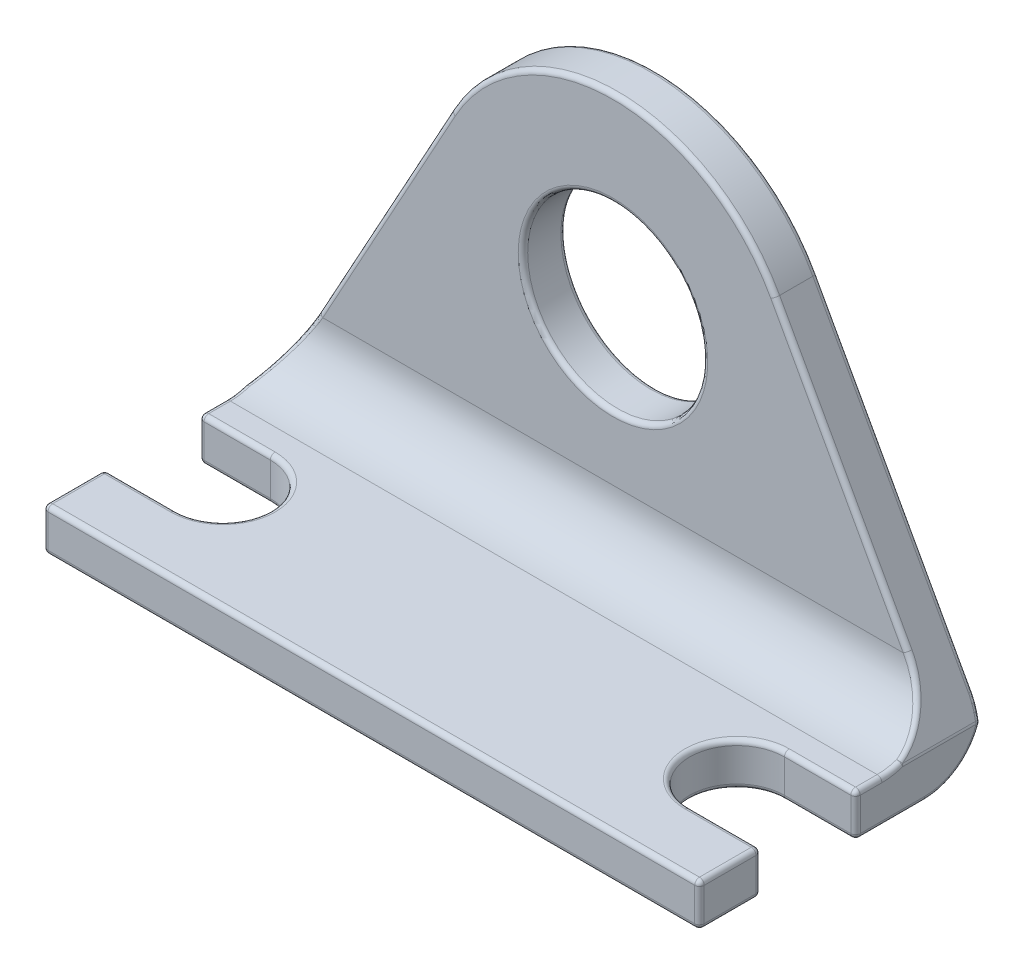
SolidWorks part; units mm, degrees
ref_plane "Front" through (0, 0, 0) normal (0, 0, 1) x (1, 0, 0)
ref_plane "Top" through (0, 0, 0) normal (0, 1, 0) x (1, 0, 0)
ref_plane "Right" through (0, 0, 0) normal (1, 0, 0) x (0, 0, -1)
sketch "Sketch1" plane through (0, 0, 0) normal (0, 1, 0) x (1, 0, 0)
  line L1 (0, 0) -> (35.179, 0)
  line L2 (0, 0) -> (0, 15.24)
  line L3 (0, 15.24) -> (35.179, 15.24)
  line L4 (35.179, 0) -> (35.179, 15.24)
  dimension "D1" = 15.24
  dimension "D2" = 35.179
extrude "Extrude1" add sketch "Sketch1" along normal blind 2.286
sketch "Sketch2" plane through (0, 0, -15.24) normal (0, 0, -1) x (-1, 0, 0)
  line L0 (-35.179, 2.286) -> (-35.179, 0) construction
  line L1 (-35.179, 0) -> (0, 0) construction
  line L2 (-35.179, 2.286) -> (-26.2698, 18.4889)
  line L3 (0, 2.286) -> (-8.9092, 18.4889)
  line L4 (-35.179, 2.286) -> (0, 2.286)
  circle A0 centre (-17.5895, 13.716) radius 4.826
  arc A1 (-8.9092, 18.4889) -> (-26.2698, 18.4889) centre (-17.5895, 13.716) ccw
  dimension "D1" = 9.652
  dimension "D4" = 5.08
  dimension "D2" = 17.5895
  dimension "D3" = 13.716
extrude "Extrude2" add sketch "Sketch2" against normal blind 2.286
fillet "Fillet1" radius 3.175 7 edges at (17.5895, 0, -15.24) (0, 1.143, -15.24) (35.179, 1.143, -15.24)
sketch "Sketch3" plane through (0, 0, 0) normal (0, -1, 0) x (1, 0, 0)
  line L0 (0, -12.065) -> (0, 0) construction
  line L1 (0, -3.2852) -> (3.81, -3.2852)
  line L2 (0, -3.2852) -> (0, -8.3652)
  line L3 (0, -8.3652) -> (3.81, -8.3652)
  arc A0 (3.81, -8.3652) -> (3.81, -3.2852) centre (3.81, -5.8252) ccw
  dimension "D1" = 5.08
  dimension "D2" = 3.81
extrude "Cut-Extrude1" cut sketch "Sketch3" against normal through all
ref_plane "Plane1" through (17.5895, 0, 0) normal (1, 0, 0) x (0, 0, -1)
mirror "Mirror1" about plane through (17.5895, 0, 0) normal (1, 0, 0) of "Cut-Extrude1"
fillet "Fillet3" radius 0.254 44 edges at (17.5895, 23.622, -12.954) (12.7635, 13.716, -12.954) (17.5895, 23.622, -15.24) (30.48, 10.8319, -15.24) (12.7635, 13.716, -15.24) (4.699, 10.8319, -15.24) (0.2419, 2.726, -15.2081) (0, 0, -10.2151) (0, 0.635, -13.97) (35.179, 0.635, -13.97) (34.9371, 2.726, -15.2081) (0.5113, 3.2159, -12.0241) (34.6677, 3.2159, -12.0241) (35.179, 0, -1.6426) (0, 0, -1.6426) (17.5895, 0, 0) (0, 1.143, -8.3652) (1.905, 2.286, -3.2852) (0, 1.143, -3.2852) (6.35, 2.286, -5.8252) (1.905, 2.286, -8.3652) (1.905, 0, -8.3652) (6.35, 0, -5.8252) (1.905, 0, -3.2852) (35.179, 0, -10.2151) (17.5895, 2.286, 0) (35.179, 1.143, -3.2852) (35.179, 1.143, -8.3652) (33.274, 0, -8.3652) (28.829, 0, -5.8252) (33.274, 0, -3.2852) (35.179, 1.143, 0) (33.274, 2.286, -8.3652) (28.829, 2.286, -5.8252) (33.274, 2.286, -3.2852) (0, 1.143, 0)
fillet "Fillet4" radius 0.254 12 edges at (35.1643, 2.3127, -10.9059) (34.9053, 2.7837, -14.9405) (35.0295, 2.4426, -10.8341) (0.1495, 2.4426, -10.8341) (35.1258, 2.2165, -14.9884) (0.0532, 2.2165, -14.9884) (0.715, 3.5864, -12.5665) (0.0098, 2.3037, -10.9264)
